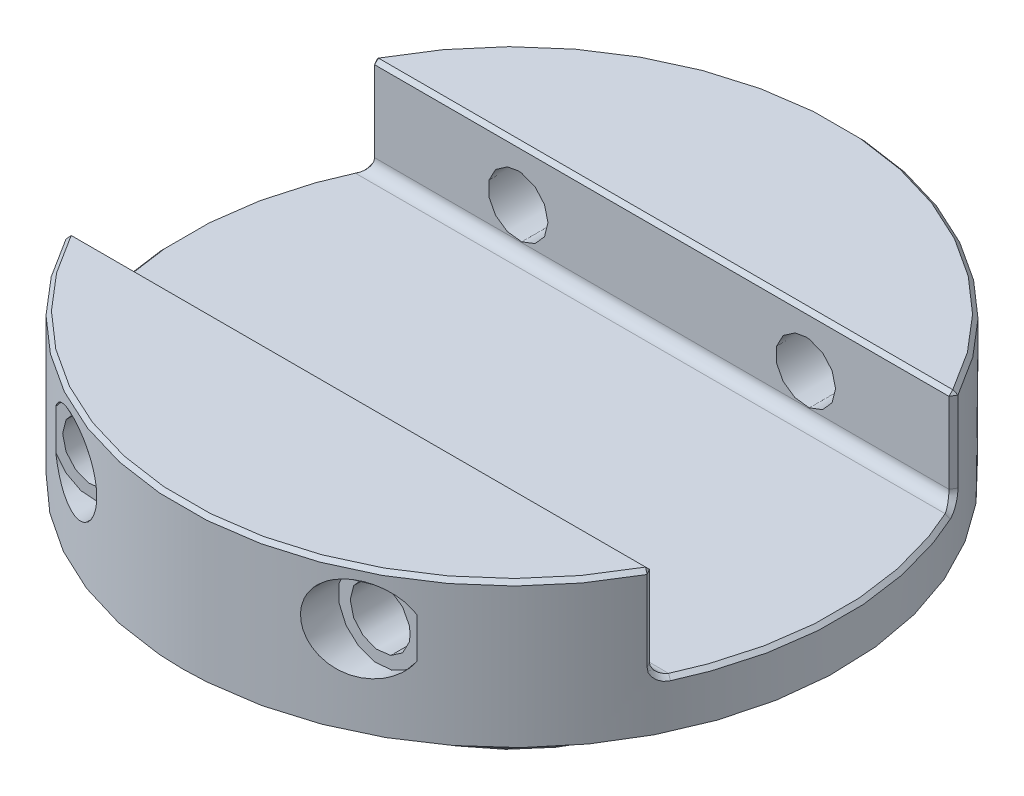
SolidWorks part; units mm, degrees
ref_plane "Top" through (0, 0, 0) normal (0, 0, 1) x (1, 0, 0)
ref_plane "Right" through (0, 0, 0) normal (0, 1, 0) x (1, 0, 0)
ref_plane "Front" through (0, 0, 0) normal (1, 0, 0) x (0, 0, -1)
sketch "Sketch2" plane through (0, 0, 0) normal (0, 1, 0) x (1, 0, 0)
  circle A0 centre (0, 0) radius 43.6562
  dimension "D1" = 87.3125
extrude "Base-Extrude" add sketch "Sketch2" along normal blind 19.05
sketch "Sketch4" plane through (0, 0, 0) normal (0, -1, 0) x (1, 0, 0)
  circle A0 centre (0, 0) radius 25.3619
  dimension "D1" = 50.7238
extrude "Boss-Extrude1" add sketch "Sketch4" along normal blind 13.4937
sketch "Sketch5" plane through (0, 0, 0) normal (1, 0, 0) x (0, 0, -1)
  line L0 (-19.8438, 19.05) -> (19.8438, 19.05)
  line L1 (-19.8438, 19.05) -> (-19.8438, 6.35)
  line L2 (19.8437, 6.35) -> (-19.8438, 6.35)
  line L3 (19.8437, 6.35) -> (19.8438, 19.05)
  line L4 (-43.6562, 19.05) -> (43.6562, 19.05) construction
  line L5 (0, 27.9661) -> (0, -22.2319) construction
  line L6 (0, -13.4937) -> (0, 0) construction
  dimension "D1" = 39.6875
  dimension "D2" = 12.7
extrude "Cut-Extrude1" cut sketch "Sketch5" against normal through all and the other way through all
sketch "Sketch7" plane through (0, 0, 0) normal (0, 0, 1) x (1, 0, 0)
  line L0 (0, 32.5053) -> (0, -19.2058) construction
  line L1 (0, -13.4937) -> (0, 0) construction
  line L2 (-38.8856, 19.05) -> (38.8856, 19.05) construction
  circle A0 centre (-19.05, 11.9063) radius 3.9688
  dimension "D3" = 7.9375
  dimension "D1" = 19.05
  dimension "D2" = 7.1437
extrude "Cut-Extrude2" cut sketch "Sketch7" along normal through all
ref_plane "Plane1" through (0, 0, 36.5125) normal (0, 0, 1) x (1, 0, 0)
sketch "Sketch8" plane through (0, 0, 36.5125) normal (0, 0, 1) x (1, 0, 0)
  circle A0 centre (-19.05, 11.9063) radius 5.5562
  dimension "D1" = 11.1125
extrude "Cut-Extrude3" cut sketch "Sketch8" along normal through all
mirror "Mirror1" about plane through (0, 0, 0) normal (1, 0, 0) of "Cut-Extrude2", "Cut-Extrude3"
mirror "Mirror2" about plane through (0, 0, 0) normal (0, 0, 1) of "Cut-Extrude3", "Cut-Extrude2", "Mirror1"
fillet "fr" radius 1.524 2 edges at (0, 6.35, -19.8437) (0, 6.35, 19.8438)
chamfer "Chamfer1" distance 0.508 angle 45 19 edges at (0, 19.05, 43.6562) (0, 19.05, -19.8438) (0, 19.05, 19.8438) (-38.8856, 13.462, 19.8438) (38.8856, 13.462, -19.8438) (0, -13.4937, -25.3619) (43.6562, 6.35, 0) (-43.6562, 6.35, 0) (0, 6.35, -18.3197) (0, 6.35, 18.3197) (38.8856, 13.462, 19.8438) (0, 7.874, 19.8438) (-38.8856, 13.462, -19.8438) (0, 7.874, -19.8438) (39.1322, 6.7538, 19.353) (-39.0257, 6.998, 19.5668) (39.0257, 6.998, -19.5668) (-39.1322, 6.7538, -19.353) (0, 19.05, -43.6562)
